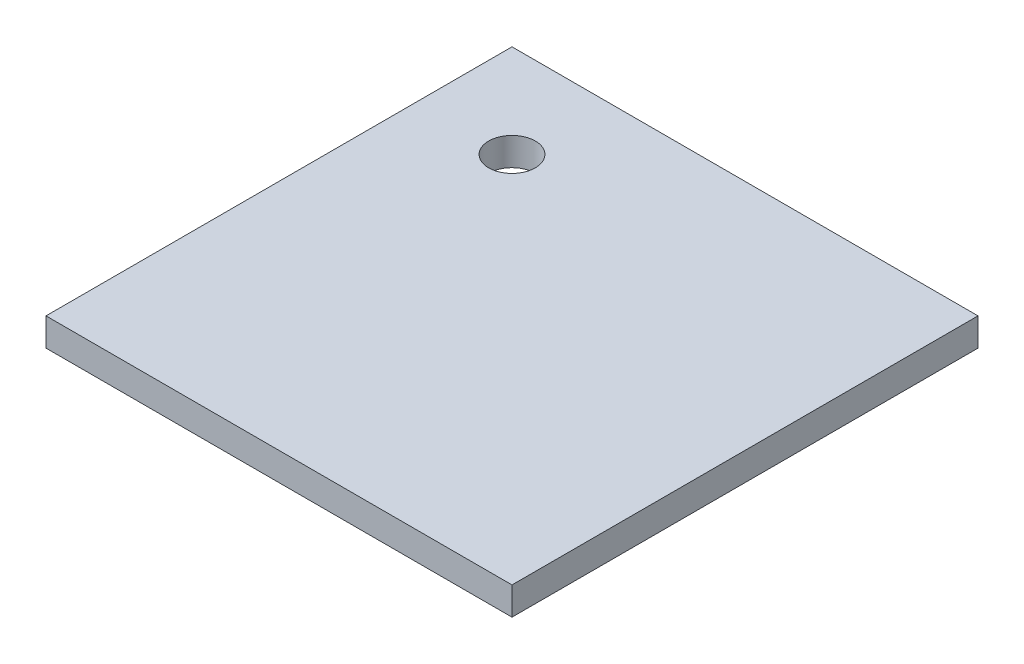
SolidWorks part; units mm, degrees
ref_plane "正面" through (0, 0, 0) normal (0, 0, 1) x (1, 0, 0)
ref_plane "平面" through (0, 0, 0) normal (0, 1, 0) x (1, 0, 0)
ref_plane "右側面" through (0, 0, 0) normal (1, 0, 0) x (0, 0, -1)
sketch "ｽｹｯﾁ1" plane through (0, 0, 0) normal (0, 0, 1) x (1, 0, 0)
  line L1 (0, 0) -> (1000, 0)
  line L2 (0, 0) -> (0, 60)
  line L3 (0, 60) -> (1000, 60)
  line L4 (1000, 0) -> (1000, 60)
  dimension "D1" = 1000
  dimension "D2" = 60
extrude "押し出し1" add sketch "ｽｹｯﾁ1" along normal blind 1000
sketch "ｽｹｯﾁ2" plane through (0, 60, 0) normal (0, 1, 0) x (1, 0, 0)
  line L0 (0, -1000) -> (0, 0) construction
  line L1 (1000, 0) -> (0, 0) construction
  circle A0 centre (200, -200) radius 50
  dimension "D1" = 100
  dimension "D2" = 200
  dimension "D3" = 200
extrude "押し出し2" cut sketch "ｽｹｯﾁ2" against normal through all
